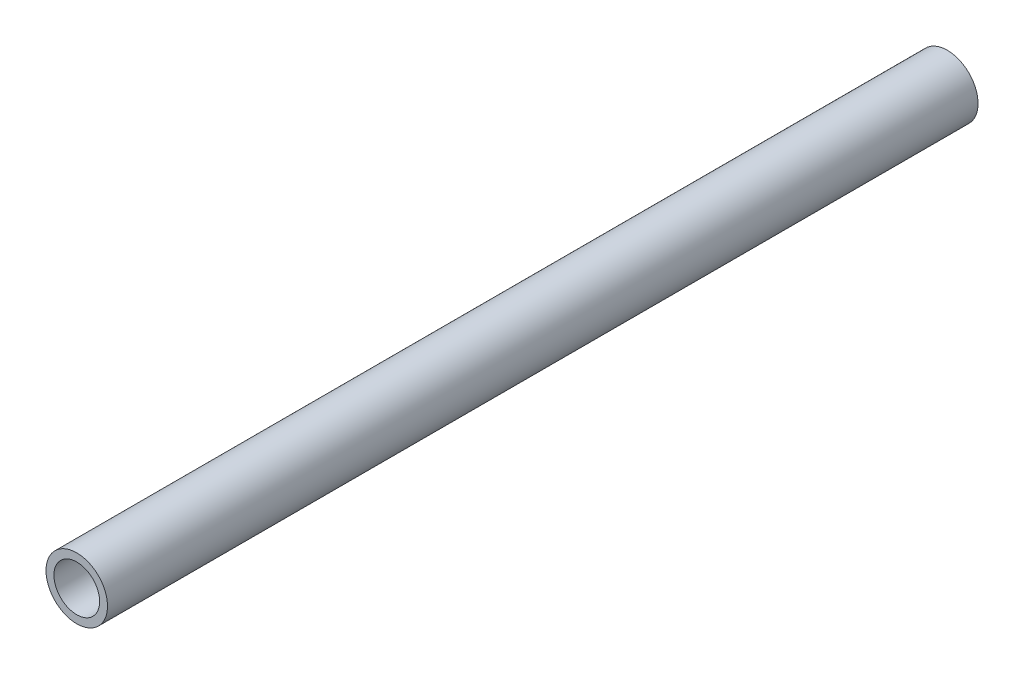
SolidWorks part; units mm, degrees
ref_plane "Front Plane" through (0, 0, 0) normal (0, 0, 1) x (1, 0, 0)
ref_plane "Top Plane" through (0, 0, 0) normal (0, 1, 0) x (1, 0, 0)
ref_plane "Right Plane" through (0, 0, 0) normal (1, 0, 0) x (0, 0, -1)
sketch "Sketch1" plane through (0, 0, 0) normal (0, 0, 1) x (1, 0, 0)
  circle A0 centre (0, 0) radius 10.7696
  circle A1 centre (0, 0) radius 8.001
  dimension "D1" = 21.5392
  dimension "D2" = 16.002
extrude "Boss-Extrude1" add sketch "Sketch1" along normal mid plane 304.8
